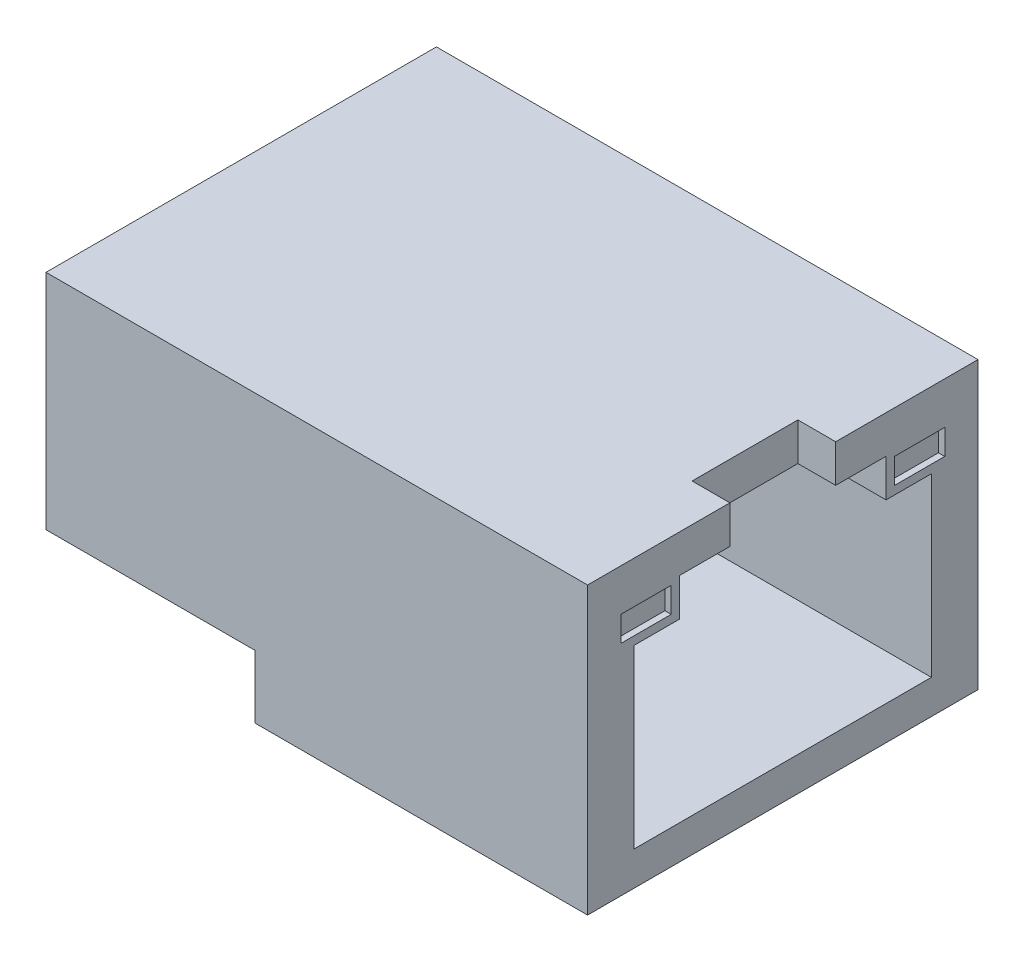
SolidWorks part; units mm, degrees
ref_plane "Front" through (0, 0, 0) normal (0, 0, 1) x (1, 0, 0)
ref_plane "Top" through (0, 0, 0) normal (0, 1, 0) x (1, 0, 0)
ref_plane "Right" through (0, 0, 0) normal (1, 0, 0) x (0, 0, -1)
sketch "Sketch1" plane through (0, 0, 0) normal (0, 0, 1) x (1, 0, 0)
  line L0 (-10.75, 4.8498) -> (10.75, 4.8498)
  line L1 (10.75, 4.8498) -> (10.75, -6.5002)
  line L2 (10.75, -6.5002) -> (-2.45, -6.5002)
  line L3 (-2.45, -6.5002) -> (-2.45, -4.0002)
  line L4 (-2.45, -4.0002) -> (-10.75, -4.0002)
  line L5 (-10.75, -4.0002) -> (-10.75, 4.8498)
extrude "Boss-Extrude1" add sketch "Sketch1" along normal blind 15.5
sketch "Sketch2" plane through (0, -4.0002, 0) normal (0, -1, 0) x (1, 0, 0)
  line L0 (10.75, 7.75) -> (-10.75, 7.75) construction
  line L1 (10.75, 15.5) -> (10.75, 0) construction
  line L2 (-10.75, 15.5) -> (-10.75, 0) construction
  line L3 (-7.45, 15.7116) -> (-7.45, -0.834) construction
  circle A0 centre (-7.45, 11.25) radius 0.55
  circle A1 centre (-7.45, 4.25) radius 0.55
  dimension "D2" = 3.5
  dimension "D1" = 18.2
  dimension "D3" = 3.5
extrude "Boss-Extrude2" add sketch "Sketch2" along normal blind 1.6
chamfer "Chamfer1" distance 0.1 angle 45 2 edges at (-7.45, -5.6002, 3.7) (-7.45, -5.6002, 10.7)
sketch "Sketch3" plane through (10.75, 0, 0) normal (1, 0, 0) x (0, 0, -1)
  line L0 (-9.85, 3.3498) -> (-5.65, 3.3498)
  line L1 (-9.85, 3.3498) -> (-9.85, 4.8498)
  line L2 (-9.85, 4.8498) -> (-5.65, 4.8498)
  line L3 (-5.65, 3.3498) -> (-5.65, 4.8498)
  line L4 (-15.5, 4.8498) -> (0, 4.8498) construction
  line L5 (0, -6.5002) -> (0, 4.8498) construction
  dimension "D1" = 4.2
  dimension "D2" = 1.5
  dimension "D3" = 0
  dimension "D4" = 5.65
extrude "Cut-Extrude1" cut sketch "Sketch3" against normal blind 1.5
sketch "Sketch4" plane through (10.75, 0, 0) normal (1, 0, 0) x (0, 0, -1)
  line L0 (-11.85, 1.8498) -> (-3.65, 1.8498)
  line L1 (-11.85, 1.8498) -> (-11.85, 3.3498)
  line L2 (-11.85, 3.3498) -> (-3.65, 3.3498)
  line L3 (-3.65, 1.8498) -> (-3.65, 3.3498)
  line L4 (-7.75, 3.3498) -> (-7.75, -7.3778) construction
  line L5 (-9.85, 3.3498) -> (-5.65, 3.3498) construction
  dimension "D1" = 1.5
  dimension "D2" = 8.2
  dimension "D3" = 4.1
  dimension "D4" = 0
extrude "Cut-Extrude2" cut sketch "Sketch4" against normal blind 12
sketch "Sketch5" plane through (10.75, 0, 0) normal (1, 0, 0) x (0, 0, -1)
  line L0 (0, -6.5002) -> (0, 4.8498) construction
  line L2 (-13.65, 1.8498) -> (-1.85, 1.8498)
  line L3 (-13.65, 1.8498) -> (-13.65, -5.1502)
  line L4 (-13.65, -5.1502) -> (-1.85, -5.1502)
  line L5 (-11.85, 1.8498) -> (-3.65, 1.8498) construction
  line L7 (-1.85, 1.8498) -> (-1.85, -5.1502)
  dimension "D1" = 11.8
  dimension "D2" = 7
  dimension "D3" = 1.85
  dimension "D4" = 0
extrude "Cut-Extrude3" cut sketch "Sketch5" against normal blind 12
sketch "Sketch6" plane through (10.75, 0, 0) normal (1, 0, 0) x (0, 0, -1)
  line L1 (-14.18, 3.1798) -> (-12.18, 3.1798)
  line L2 (-14.18, 3.1798) -> (-14.18, 2.1798)
  line L3 (-14.18, 2.1798) -> (-12.18, 2.1798)
  line L4 (-12.18, 3.1798) -> (-12.18, 2.1798)
  line L5 (-11.85, 3.3498) -> (-11.85, 1.8498) construction
  line L6 (-11.85, 1.8498) -> (-13.65, 1.8498) construction
  line L7 (-7.75, 6.2913) -> (-7.75, -10.9452) construction
  line L8 (-3.32, 3.1798) -> (-3.32, 2.1798)
  line L9 (-1.32, 2.1798) -> (-3.32, 2.1798)
  line L10 (-1.32, 3.1798) -> (-1.32, 2.1798)
  line L11 (-1.32, 3.1798) -> (-3.32, 3.1798)
  point P4 (-12.75, 1.8498)
  dimension "D1" = 2
  dimension "D2" = 1
  dimension "D3" = 0.33
  dimension "D4" = 0.33
extrude "Cut-Extrude4" cut sketch "Sketch6" against normal blind 0.25
